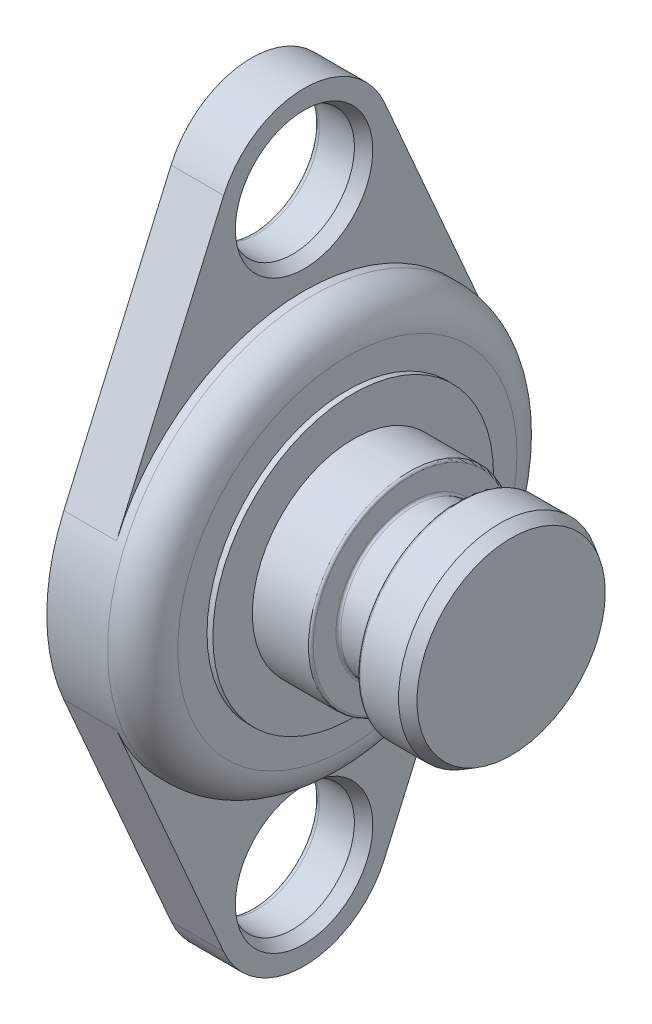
SolidWorks part; units mm, degrees
ref_plane "Plan de face" through (0, 0, 0) normal (0, 0, 1) x (1, 0, 0)
ref_plane "Plan de dessus" through (0, 0, 0) normal (0, 1, 0) x (1, 0, 0)
ref_plane "Plan de droite" through (0, 0, 0) normal (1, 0, 0) x (0, 0, -1)
sketch "Esquisse1" plane through (0, 0, 0) normal (0, 1, 0) x (1, 0, 0)
  line L0 (0, 0) -> (-40.2089, 0) construction
  line L1 (0, 0) -> (0, 8.0476)
  line L2 (-1, 8.625) -> (-4.3, 8.625)
  line L3 (-4.5, 8.425) -> (-4.5, 6.475)
  line L4 (-4.7, 6.275) -> (-8.3, 6.275)
  line L5 (-8.5, 6.475) -> (-8.5, 8.425)
  line L6 (-8.7, 8.625) -> (-13.5, 8.625)
  line L7 (-13.5, 8.625) -> (-13.5, 12)
  line L8 (-13.5, 12) -> (-14, 12)
  line L9 (-14, 12) -> (-14, 14.5)
  line L10 (-17, 17.5) -> (-17.7, 17.5)
  line L11 (-17.7, 17.5) -> (-17.7, 0)
  line L12 (0, 0) -> (-17.7, 0)
  line L13 (0, 8.0476) -> (-1, 8.625)
  arc A0 (-17, 17.5) -> (-14, 14.5) centre (-17, 14.5) cw
  arc A1 (-8.3, 6.275) -> (-8.5, 6.475) centre (-8.3, 6.475) cw
  arc A2 (-4.5, 6.475) -> (-4.7, 6.275) centre (-4.7, 6.475) cw
  arc A3 (-4.5, 8.425) -> (-4.3, 8.625) centre (-4.3, 8.425) cw
  arc A4 (-8.7, 8.625) -> (-8.5, 8.425) centre (-8.7, 8.425) cw
  point P18 (-8.5, 6.275)
  point P21 (-4.5, 6.275)
  dimension "D11" = 3
  dimension "D12" = 0.2
  dimension "D13" = 30
  dimension "D1" = 12.55
  dimension "D2" = 17.25
  dimension "D3" = 17.25
  dimension "D4" = 4
  dimension "D5" = 3.7
  dimension "D6" = 0.5
  dimension "D7" = 9.2
  dimension "D8" = 4.5
  dimension "D9" = 24
  dimension "D10" = 35
  dimension "D14" = 1
revolve "Révolution1" add sketch "Esquisse1" angle 360 about L0
sketch "Esquisse2" plane through (-17.7, 0, 0) normal (-1, 0, 0) x (0, 0, 1)
  line L0 (-6.8739, 28) -> (-16.039, 7)
  line L1 (6.8739, 28) -> (16.039, 7)
  line L2 (-16.039, -7) -> (-6.8739, -28)
  line L3 (16.039, -7) -> (6.8739, -28)
  arc A0 (6.8739, 28) -> (-6.8739, 28) centre (0, 25) ccw
  arc A1 (-6.8739, -28) -> (6.8739, -28) centre (0, -25) ccw
  arc A2 (16.039, -7) -> (16.039, 7) centre (0, 0) ccw
  circle A3 centre (0, 0) radius 17.5 construction
  arc A4 (-16.039, 7) -> (-16.039, -7) centre (0, 0) ccw
  circle A5 centre (0, 25) radius 5.3
  circle A6 centre (0, -25) radius 5.3
  dimension "D1" = 15
  dimension "D2" = 15
  dimension "D5" = 10.6
  dimension "D6" = 10.6
  dimension "D3" = 25
  dimension "D4" = 25
extrude "Extrusion1" add sketch "Esquisse2" along normal blind 4.5
chamfer "Chanfrein1" distance 1 angle 30 2 edges at (-17.7, 25, 5.3) (-17.7, -25, 5.3)
fillet "Congé1" radius 0.5 2 edges at (-22.2, -25, 5.3) (-22.2, 25, 5.3)
